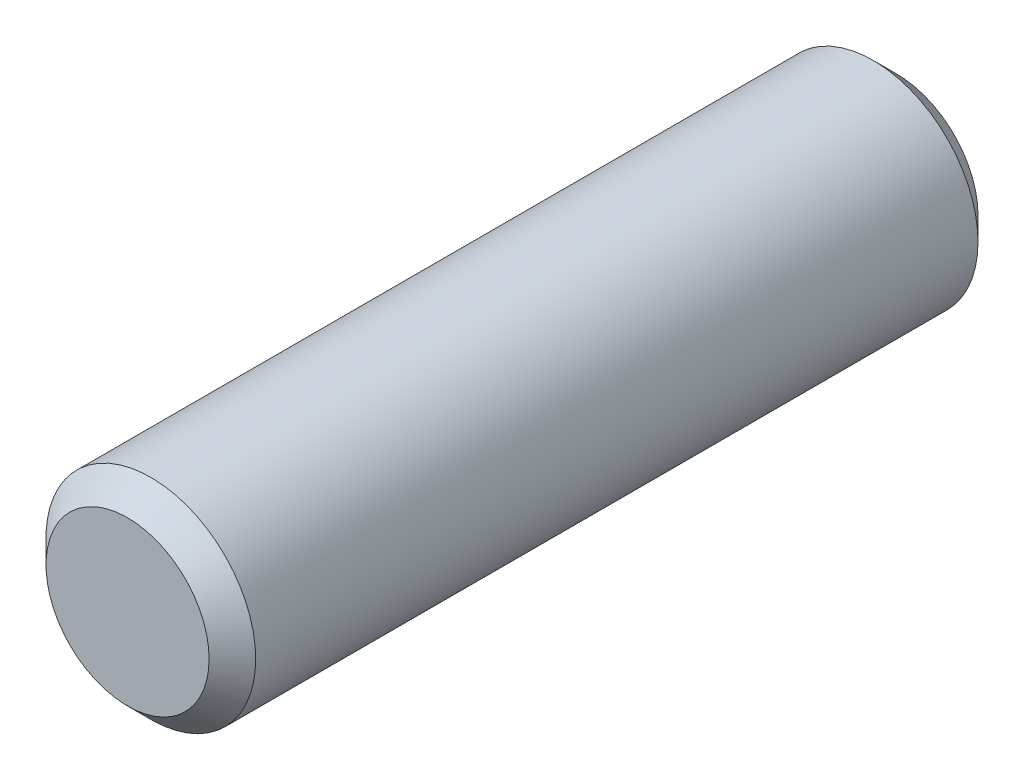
SolidWorks part; units mm, degrees
ref_plane "face" through (0, 0, 0) normal (0, 0, 1) x (1, 0, 0)
ref_plane "dessus" through (0, 0, 0) normal (0, 1, 0) x (1, 0, 0)
ref_plane "profil" through (0, 0, 0) normal (1, 0, 0) x (0, 0, -1)
sketch "Esquisse1" plane through (0, 0, 0) normal (0, 0, 1) x (1, 0, 0)
  circle A0 centre (0, 0) radius 4.5
  dimension "D1" = 9
extrude "Base-Extrusion" add sketch "Esquisse1" along normal mid plane 33
chamfer "Chanfrein1" distance 1 angle 45 2 edges at (4.5, 0, -16.5) (4.5, 0, 16.5)
